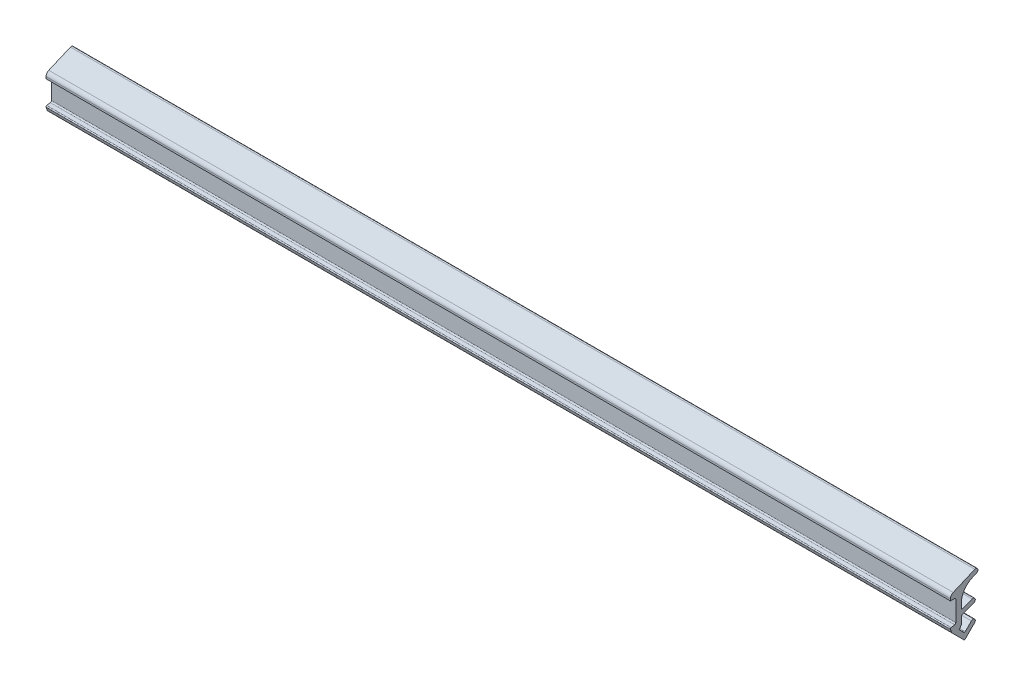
SolidWorks part; units mm, degrees
ref_plane "Front Plane" through (0, 0, 0) normal (0, 0, 1) x (1, 0, 0)
ref_plane "Top Plane" through (0, 0, 0) normal (0, 1, 0) x (1, 0, 0)
ref_plane "Right Plane" through (0, 0, 0) normal (1, 0, 0) x (0, 0, -1)
sketch3d "3DSketch1"
  line L0 (0, 0, 0) -> (200, 0, 0)
other "Paneelitiivisteet 1.6021 PANEELITIIVISTE 5(1)"
ref_plane "Plane1" through (0, 0, 0) normal (1, 0, 0) x (0, 0, -1)
sketch "Sketch1" plane through (0, 0, 0) normal (1, 0, 0) x (0, 0, -1)
  line L0 (2.8125, 5.6562) -> (3.773, 6.0645)
  line L1 (3.3817, 6.9848) -> (-1.4139, 4.9462)
  line L2 (-2.0227, 4.0259) -> (-2.0227, 3.6247)
  line L3 (-2.0227, 3.6247) -> (-1.1227, 3.6247)
  line L4 (-0.8227, 3.3247) -> (-0.8227, -1.1236)
  line L5 (-1.0706, -1.4191) -> (-1.8574, -1.5578)
  line L6 (-2.0106, -1.8232) -> (-1.7266, -2.6035)
  line L7 (-1.68, -2.6765) -> (0.9602, -5.3168)
  line L8 (1.243, -5.3168) -> (3.3309, -3.2289)
  line L9 (2.6238, -2.5218) -> (1.243, -3.9026)
  line L10 (0.9602, -3.9026) -> (0.0506, -2.993)
  line L11 (0.0188, -2.7516) -> (0.4506, -2.0038)
  line L12 (0.4773, -1.9038) -> (0.4773, -0.4574)
  line L13 (0.6089, -0.2695) -> (3.1484, 0.6548)
  line L14 (2.8063, 1.5945) -> (0.6458, 0.8081)
  line L15 (0.3773, 0.996) -> (0.3773, 1.975)
  arc A0 (3.773, 6.0645) -> (3.3817, 6.9848) centre (3.5773, 6.5247) ccw
  arc A1 (-1.4139, 4.9462) -> (-2.0227, 4.0259) centre (-1.0227, 4.0259) ccw
  arc A2 (-0.8227, 3.3247) -> (-1.1227, 3.6247) centre (-1.1227, 3.3247) ccw
  arc A3 (-1.0706, -1.4191) -> (-0.8227, -1.1236) centre (-1.1227, -1.1236) ccw
  arc A4 (-1.8574, -1.5578) -> (-2.0106, -1.8232) centre (-1.8227, -1.7548) ccw
  arc A5 (-1.7266, -2.6035) -> (-1.68, -2.6765) centre (-1.5386, -2.5351) ccw
  arc A6 (0.9602, -5.3168) -> (1.243, -5.3168) centre (1.1016, -5.1753) ccw
  arc A7 (3.3309, -3.2289) -> (2.6238, -2.5218) centre (2.9773, -2.8753) ccw
  arc A8 (0.9602, -3.9026) -> (1.243, -3.9026) centre (1.1016, -3.7611) ccw
  arc A9 (0.0188, -2.7516) -> (0.0506, -2.993) centre (0.192, -2.8516) ccw
  arc A10 (0.4506, -2.0038) -> (0.4773, -1.9038) centre (0.2773, -1.9038) ccw
  arc A11 (0.6089, -0.2695) -> (0.4773, -0.4574) centre (0.6773, -0.4574) ccw
  arc A12 (3.1484, 0.6548) -> (2.8063, 1.5945) centre (2.9773, 1.1247) ccw
  arc A13 (0.3773, 0.996) -> (0.6458, 0.8081) centre (0.5773, 0.996) ccw
  arc A14 (2.8125, 5.6562) -> (0.3773, 1.975) centre (4.3773, 1.975) ccw
  point P46 (0, 0)
